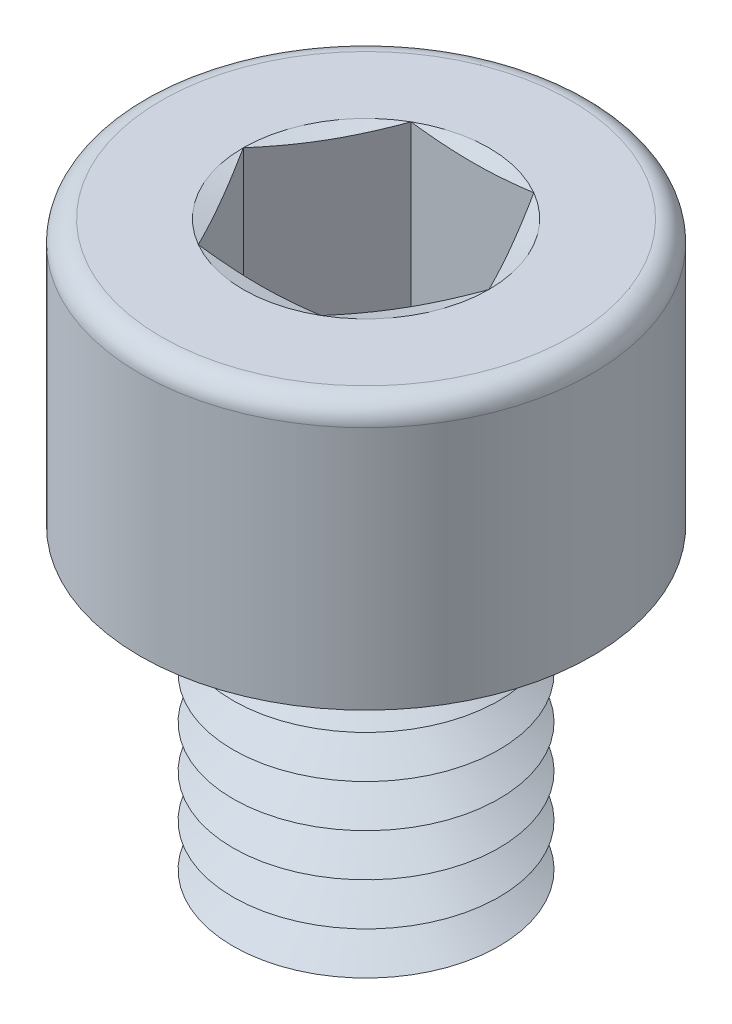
SolidWorks part; units mm, degrees
ref_plane "Front Plane" through (0, 0, 0) normal (0, 0, 1) x (1, 0, 0)
ref_plane "Top Plane" through (0, 0, 0) normal (0, 1, 0) x (1, 0, 0)
ref_plane "Right Plane" through (0, 0, 0) normal (1, 0, 0) x (0, 0, -1)
sketch "Sketch1" plane through (0, 0, 0) normal (0, 1, 0) x (1, 0, 0)
  circle A0 centre (0, 0) radius 2.5
  dimension "D1" = 5
extrude "Extrude1" add sketch "Sketch1" along normal blind 6
sketch "Sketch2" plane through (0, 6, 0) normal (0, 1, 0) x (1, 0, 0)
  circle A0 centre (0, 0) radius 4.25
  dimension "D1" = 8.5
extrude "Extrude2" add sketch "Sketch2" along normal blind 5
sketch "Sketch3" plane through (0, 11, 0) normal (0, 1, 0) x (1, 0, 0)
  line L1 (1.1547, 2) -> (-1.1547, 2)
  line L2 (-1.1547, 2) -> (-2.3094, 0)
  line L3 (-2.3094, 0) -> (-1.1547, -2)
  line L4 (-1.1547, -2) -> (1.1547, -2)
  line L5 (1.1547, -2) -> (2.3094, 0)
  line L6 (2.3094, 0) -> (1.1547, 2)
  circle A0 centre (0, 0) radius 2 construction
  dimension "D1" = 4
extrude "Extrude3" cut sketch "Sketch3" against normal blind 4
fillet "Fillet1" radius 0.4 1 edges at (0, 11, 4.25)
sketch "Sketch4" plane through (0, 0, 0) normal (1, 0, 0) x (0, 0, -1)
  line L0 (-2, 7) -> (0, 7)
  line L1 (0, 7) -> (0, 5.8453)
  line L2 (0, 5.8453) -> (-2, 7)
  dimension "D1" = 30
revolve "Cut-Revolve1" cut sketch "Sketch4" angle 360 about L1
sketch "Sketch5" plane through (0, 0, 0) normal (0, 0, 1) x (1, 0, 0)
  line L0 (-2.5, 0.4) -> (-2.5, -0.4)
  line L1 (-2.5, 6) -> (-2.5, 0) construction
  line L2 (-2.5, -0.4) -> (-1.8072, 0)
  line L3 (-2.5, 0) -> (2.5, 0) construction
  line L4 (-1.8072, 0) -> (-2.5, 0.4)
  dimension "D1" = 0.8
revolve "Cut-Revolve2" cut sketch "Sketch5" angle 360 about axis through (0, 6, 0) along (0, -1, 0)
pattern_linear "LPattern1" count 8 spacing 0.8 along (0, 1, 0) of "Cut-Revolve2"
sketch "Sketch6" plane through (0, 11, 0) normal (0, 1, 0) x (1, 0, 0)
  circle A0 centre (0, 0) radius 2.3094
extrude "Extrude4" cut sketch "Sketch6" against normal through all draft 75
